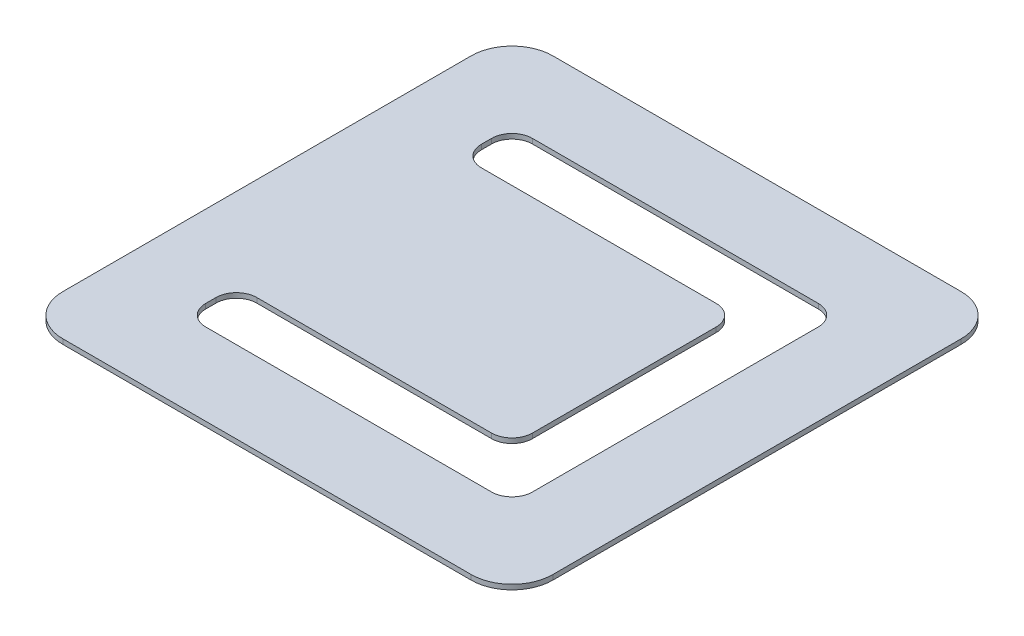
SolidWorks part; units mm, degrees
ref_plane "Front Plane" through (0, 0, 0) normal (0, 0, 1) x (1, 0, 0)
ref_plane "Top Plane" through (0, 0, 0) normal (0, 1, 0) x (1, 0, 0)
ref_plane "Right Plane" through (0, 0, 0) normal (1, 0, 0) x (0, 0, -1)
sketch "Sketch1" plane through (0, 0, 0) normal (0, 1, 0) x (1, 0, 0)
  line L0 (76.2, 76.2) -> (-76.2, -76.2) construction
  line L1 (-63.5, 76.2) -> (63.5, 76.2)
  line L2 (-76.2, 63.5) -> (-76.2, -63.5)
  line L3 (-63.5, -76.2) -> (63.5, -76.2)
  line L4 (76.2, 63.5) -> (76.2, -63.5)
  line L5 (-44.45, 50.8) -> (44.45, 50.8)
  line L6 (50.8, 44.45) -> (50.8, -44.45)
  line L7 (-44.45, -50.8) -> (44.45, -50.8)
  line L8 (-50.8, 44.45) -> (-50.8, 41.275)
  line L9 (-78.3129, 0) -> (50.8, 0) construction
  line L10 (-44.45, 34.925) -> (28.575, 34.925)
  line L11 (28.575, -34.925) -> (-44.45, -34.925)
  line L12 (-50.8, -41.275) -> (-50.8, -44.45)
  line L13 (-50.8, 50.8) -> (-50.8, -50.8) construction
  line L14 (-50.8, 50.8) -> (50.8, 50.8) construction
  line L15 (50.8, 50.8) -> (50.8, -50.8) construction
  line L16 (-50.8, -50.8) -> (50.8, -50.8) construction
  line L17 (34.925, 28.575) -> (34.925, -28.575)
  arc A0 (63.5, 76.2) -> (76.2, 63.5) centre (63.5, 63.5) cw
  arc A1 (-63.5, 76.2) -> (-76.2, 63.5) centre (-63.5, 63.5) ccw
  arc A2 (-76.2, -63.5) -> (-63.5, -76.2) centre (-63.5, -63.5) ccw
  arc A3 (63.5, -76.2) -> (76.2, -63.5) centre (63.5, -63.5) ccw
  arc A4 (50.8, -44.45) -> (44.45, -50.8) centre (44.45, -44.45) cw
  arc A5 (-44.45, 50.8) -> (-50.8, 44.45) centre (-44.45, 44.45) ccw
  arc A6 (34.925, -28.575) -> (28.575, -34.925) centre (28.575, -28.575) cw
  arc A7 (-44.45, 34.925) -> (-50.8, 41.275) centre (-44.45, 41.275) cw
  arc A8 (28.575, 34.925) -> (34.925, 28.575) centre (28.575, 28.575) cw
  arc A9 (44.45, 50.8) -> (50.8, 44.45) centre (44.45, 44.45) cw
  arc A10 (50.8, 50.8) -> (50.8, 50.8) centre (50.8, 50.8) cw construction
  arc A11 (50.8, -50.8) -> (50.8, -50.8) centre (50.8, -50.8) ccw construction
  arc A12 (-50.8, 50.8) -> (-50.8, 50.8) centre (-50.8, 50.8) ccw construction
  arc A13 (-50.8, -41.275) -> (-44.45, -34.925) centre (-44.45, -41.275) cw
  arc A14 (-50.8, -44.45) -> (-44.45, -50.8) centre (-44.45, -44.45) ccw
  arc A15 (-50.8, -50.8) -> (-50.8, -50.8) centre (-50.8, -50.8) ccw construction
  point P47 (-50.8, -34.925)
  point P54 (34.925, 34.925)
  dimension "D1" = 12.7
  dimension "D3" = 15.875
  dimension "D6" = 6.35
  dimension "D7" = 6.35
  dimension "D4" = 152.4
  dimension "D5" = 152.4
  dimension "D2" = 25.4
sheet metal parameters "Sheet-Metal1" thickness 1.524 parameters "D1"=6.35
base flange "Base-Flange1" sketch "Sketch1" thickness 1.524 reverse thickness direction yes parameters "D1"=6.35
flat pattern "Flat-Pattern1"
sketch "Bend-Lines1" plane through (0, 0, 0) normal (0, 1, 0) x (-1, 0, 0)
